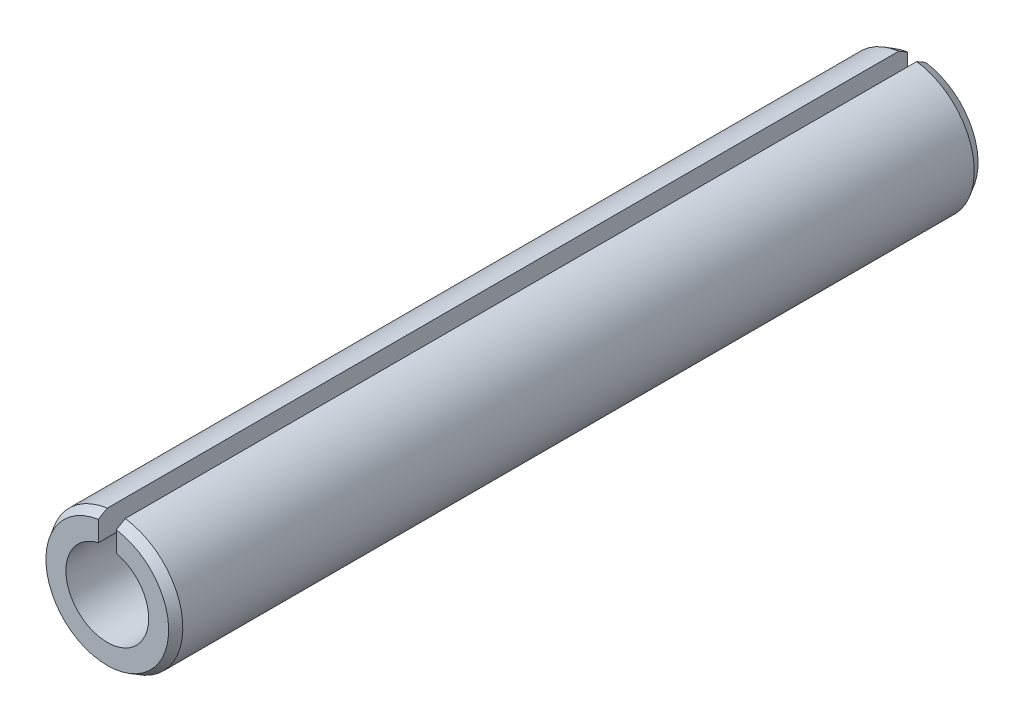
SolidWorks part; units mm, degrees
ref_plane "Plan1" through (0, 0, 0) normal (0, 0, 1) x (1, 0, 0)
ref_plane "Plan2" through (0, 0, 0) normal (0, 1, 0) x (1, 0, 0)
ref_plane "Plan3" through (0, 0, 0) normal (1, 0, 0) x (0, 0, -1)
sketch "Esquisse1" plane through (0, 0, 0) normal (0, 0, 1) x (1, 0, 0)
  line L0 (-0.5, 3.6661) -> (-0.5, 2.245)
  line L1 (0.5, 3.6661) -> (0.5, 2.245)
  arc A0 (-0.5, 3.6661) -> (0.5, 3.6661) centre (0, 0) ccw
  arc A1 (-0.5, 2.245) -> (0.5, 2.245) centre (0, 0) ccw
  dimension "D1" = 7.4
  dimension "D2" = 4.6
  dimension "D4" = 0.5
  dimension "D3" = 1
extrude "Base-Extrusion" add sketch "Esquisse1" along normal blind 45
chamfer "Chanfrein1" distance 0.5 angle 30
